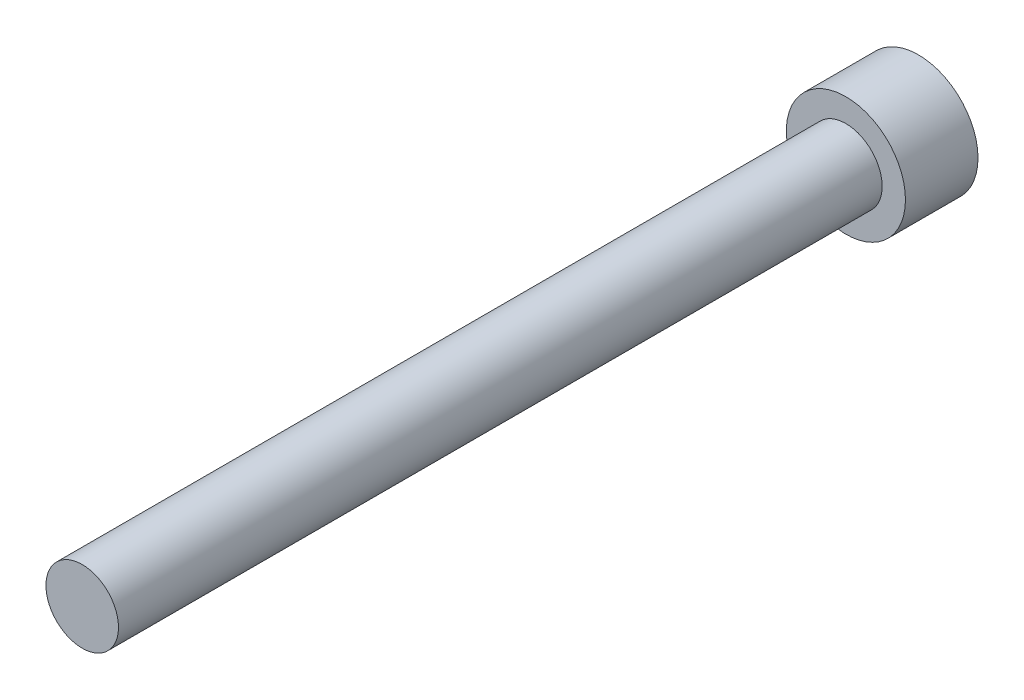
SolidWorks part; units mm, degrees
ref_plane "Front Plane" through (0, 0, 0) normal (0, 0, 1) x (1, 0, 0)
ref_plane "Top Plane" through (0, 0, 0) normal (0, 1, 0) x (1, 0, 0)
ref_plane "Right Plane" through (0, 0, 0) normal (1, 0, 0) x (0, 0, -1)
sketch "Sketch6" plane through (0, 0, 0) normal (1, 0, 0) x (0, 0, -1)
  line L0 (-50.8, 0) -> (22.525, 0) construction
  line L1 (4.3586, 0) -> (-4.3586, 0) construction
  line L2 (-50.8, 0) -> (-50.8, -2.413)
  line L3 (-50.8, -2.413) -> (0, -2.413)
  line L4 (0, 4.3586) -> (0, -4.3586) construction
  line L5 (0, -2.413) -> (0, -3.9624)
  line L6 (0, -3.9624) -> (4.826, -3.9624)
  line L7 (4.826, -3.9624) -> (4.826, 0)
  line L8 (4.826, 0) -> (-50.8, 0)
  dimension "L" = 50.8
  dimension "H" = 4.826
  dimension "A" = 7.9248
  dimension "D" = 4.826
revolve "Revolve1" add sketch "Sketch6" angle 360 about L0
sketch "Sketch7" plane through (0, 0, -4.826) normal (0, 0, -1) x (-1, 0, 0)
  line L2 (-1.9812, 1.1438) -> (-1.9812, -1.1438)
  line L4 (-1.9812, -1.1438) -> (0, -2.2877)
  line L5 (0, -2.2877) -> (1.9812, -1.1438)
  line L6 (1.9812, -1.1438) -> (1.9812, 1.1438)
  line L7 (1.9812, 1.1438) -> (0, 2.2877)
  line L8 (0, 2.2877) -> (-1.9812, 1.1438)
  circle A0 centre (0, 0) radius 1.9812 construction
  dimension "J" = 3.9624
extrude "HEX" cut sketch "Sketch7" against normal blind 3.048
